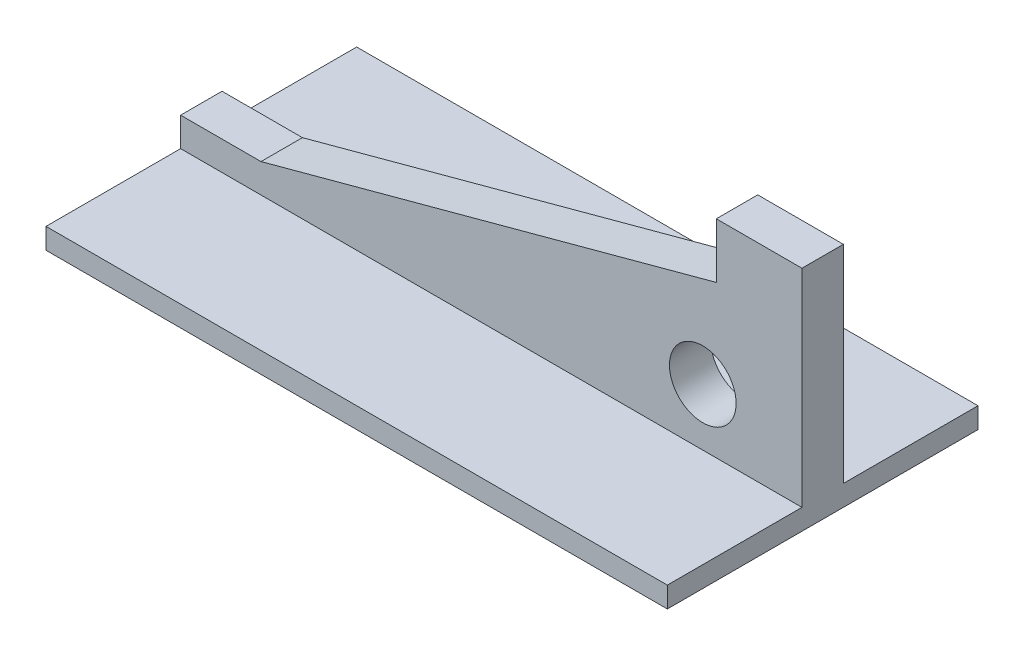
SolidWorks part; units mm, degrees
ref_plane "Front Plane" through (0, 0, 0) normal (0, 0, 1) x (1, 0, 0)
ref_plane "Top Plane" through (0, 0, 0) normal (0, 1, 0) x (1, 0, 0)
ref_plane "Right Plane" through (0, 0, 0) normal (1, 0, 0) x (0, 0, -1)
sketch "Sketch1" plane through (0, 0, 0) normal (0, 1, 0) x (1, 0, 0)
  line L0 (75, 37.5) -> (-75, -37.5) construction
  line L1 (-75, 37.5) -> (75, 37.5)
  line L2 (-75, 37.5) -> (-75, -37.5)
  line L3 (-75, -37.5) -> (75, -37.5)
  line L4 (75, 37.5) -> (75, -37.5)
  dimension "D1" = 75
  dimension "D2" = 150
extrude "Extrude1" add sketch "Sketch1" along normal blind 5
sketch "Sketch2" plane through (0, 0, 0) normal (0, 0, 1) x (1, 0, 0)
  line L0 (54.3285, 55) -> (54.3285, 41.6944)
  line L1 (54.3285, 55) -> (75, 55)
  line L2 (75, 55) -> (75, 5)
  line L3 (75, 5) -> (-75, 5)
  line L4 (-75, 5) -> (-75, 12)
  line L6 (-75, 12) -> (-55.5945, 12)
  line L7 (-55.5945, 12) -> (54.3285, 41.6944)
  circle A0 centre (51.0571, 18.7674) radius 8.0489
  dimension "D3" = 20.6715
  dimension "D4" = 16.0977
  dimension "D1" = 7
  dimension "D2" = 50
  dimension "D5" = 23.9429
  dimension "D6" = 13.7674
  dimension "D7" = 15.117
  dimension "D8" = 19.4055
extrude "Extrude2" add sketch "Sketch2" along normal mid plane 10
